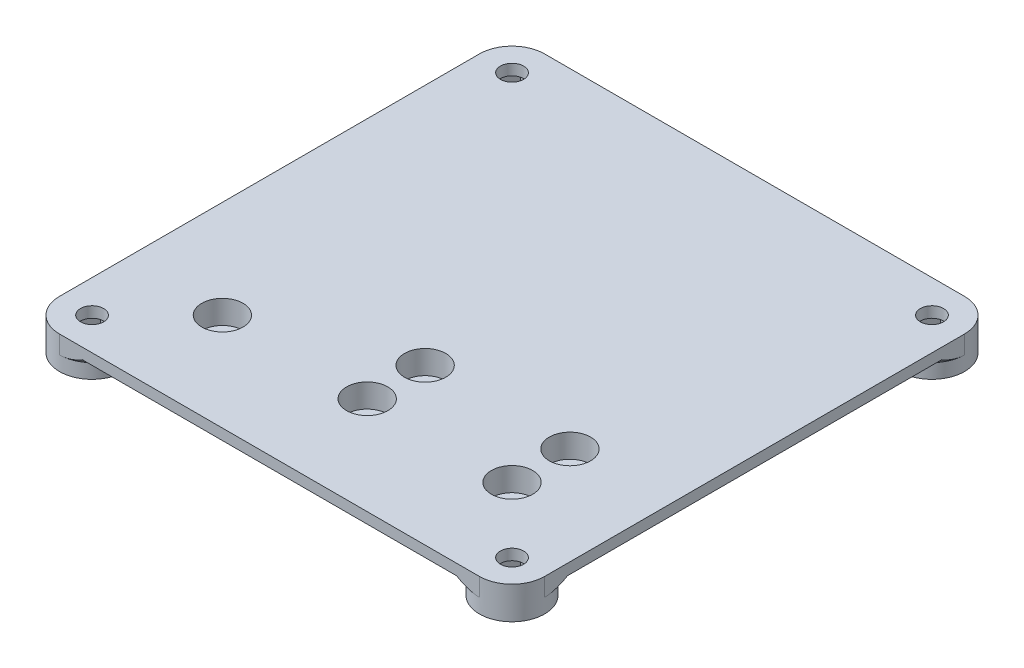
SolidWorks part; units mm, degrees
ref_plane "前视基准面" through (0, 0, 0) normal (0, 0, 1) x (1, 0, 0)
ref_plane "上视基准面" through (0, 0, 0) normal (0, 1, 0) x (1, 0, 0)
ref_plane "右视基准面" through (0, 0, 0) normal (1, 0, 0) x (0, 0, -1)
other "Configuration Table"
sketch "草图1" plane through (0, 0, 0) normal (0, 1, 0) x (1, 0, 0)
  line L0 (-29, 29) -> (29, 29) construction
  line L1 (-33.5, -33.5) -> (33.5, -33.5)
  line L2 (-33.5, -33.5) -> (-33.5, 33.5)
  line L3 (-33.5, 33.5) -> (33.5, 33.5)
  line L4 (33.5, -33.5) -> (33.5, 33.5)
  line L5 (-33.5, -33.5) -> (33.5, 33.5) construction
  line L6 (-33.5, 33.5) -> (33.5, -33.5) construction
  line L7 (-29, 29) -> (-29, -29) construction
  circle A0 centre (-29, 29) radius 1.6
  circle A1 centre (29, 29) radius 1.6
  circle A2 centre (29, -29) radius 1.6
  circle A3 centre (-29, -29) radius 1.6
  point P0 (0, 0)
  dimension "D1" = 3.2
  dimension "D2" = 2
  dimension "D3" = 90
  dimension "D4" = 58
  dimension "D5" = 58
  dimension "D6" = 29
  dimension "D7" = 29
  dimension "D8" = 4.5
  dimension "D9" = 4.5
extrude "凸台-拉伸1" add sketch "草图1" along normal blind 1.5
sketch "草图2" plane through (0, 0, 0) normal (0, -1, 0) x (1, 0, 0)
  line L0 (-20, 24) -> (20, 24)
  line L1 (24, 20) -> (24, 12)
  line L2 (20, 8) -> (0, 8)
  line L3 (-1.4856, 8.2861) -> (-21.4856, 16.2861)
  circle A0 centre (-20, 20) radius 1.3266
  circle A1 centre (0, 12) radius 1.3266
  circle A2 centre (20, 20) radius 1.3266
  circle A3 centre (0, 20) radius 1.3266
  circle A4 centre (20, 12) radius 1.3266
  arc A5 (0, 8) -> (-1.4856, 8.2861) centre (0, 12) cw
  arc A6 (24, 12) -> (20, 8) centre (20, 12) cw
  arc A7 (20, 24) -> (24, 20) centre (20, 20) cw
  arc A8 (-20, 24) -> (-21.4856, 16.2861) centre (-20, 20) ccw
  dimension "D1" = 2.6532
  dimension "D11" = 4
  dimension "D2" = 20
  dimension "D3" = 20
  dimension "D4" = 8
  dimension "D5" = 4
  dimension "D6" = 4
  dimension "D7" = 4
  dimension "D8" = 4
  dimension "D9" = 4
  dimension "D10" = 12
extrude "凸台-拉伸2" add sketch "草图2" along normal blind 8
sketch "草图3" plane through (0, 0, 0) normal (0, -1, 0) x (1, 0, 0)
  circle A0 centre (-20, 20) radius 2.85
  circle A1 centre (0, 20) radius 2.85
  circle A2 centre (0, 12) radius 2.85
  circle A3 centre (20, 12) radius 2.85
  circle A4 centre (20, 20) radius 2.85
  dimension "D1" = 5.7
extrude "切除-拉伸1" cut sketch "草图3" against normal mid plane 3.5
fillet "圆角1" radius 4.5 4 edges at (33.5, 0.75, 33.5) (33.5, 0.75, -33.5) (-33.5, 0.75, -33.5) (-33.5, 0.75, 33.5)
sketch "草图4" plane through (0, 0, 0) normal (0, -1, 0) x (1, 0, 0)
  line L0 (32.1466, 29) -> (30.5733, 31.725)
  line L1 (-25.8534, 29) -> (-27.4267, 31.725)
  line L2 (-27.4267, 31.725) -> (-30.5733, 31.725)
  line L3 (-30.5733, 31.725) -> (-32.1466, 29)
  line L4 (-32.1466, 29) -> (-30.5733, 26.275)
  line L5 (-30.5733, 26.275) -> (-27.4267, 26.275)
  line L6 (-27.4267, 26.275) -> (-25.8534, 29)
  line L7 (30.5733, 31.725) -> (27.4267, 31.725)
  line L8 (27.4267, 31.725) -> (25.8534, 29)
  line L9 (25.8534, 29) -> (27.4267, 26.275)
  line L10 (27.4267, 26.275) -> (30.5733, 26.275)
  line L11 (30.5733, 26.275) -> (32.1466, 29)
  line L12 (32.1466, -29) -> (30.5733, -26.275)
  line L13 (30.5733, -26.275) -> (27.4267, -26.275)
  line L14 (27.4267, -26.275) -> (25.8534, -29)
  line L15 (25.8534, -29) -> (27.4267, -31.725)
  line L16 (27.4267, -31.725) -> (30.5733, -31.725)
  line L17 (30.5733, -31.725) -> (32.1466, -29)
  line L18 (-25.8534, -29) -> (-27.4267, -26.275)
  line L19 (-27.4267, -26.275) -> (-30.5733, -26.275)
  line L20 (-30.5733, -26.275) -> (-32.1466, -29)
  line L21 (-32.1466, -29) -> (-30.5733, -31.725)
  line L22 (-30.5733, -31.725) -> (-27.4267, -31.725)
  line L23 (-27.4267, -31.725) -> (-25.8534, -29)
  circle A0 centre (-29, 29) radius 4.5
  circle A1 centre (-29, 29) radius 2.725 construction
  circle A2 centre (29, 29) radius 4.5
  circle A3 centre (29, -29) radius 4.5
  circle A4 centre (-29, -29) radius 4.5
  point P4 (24.1149, -20.0742)
  point P12 (29, -29)
  point P13 (-29, -29)
  dimension "D1" = 5.45
  dimension "D2" = 2
  dimension "D3" = 2
extrude "凸台-拉伸3" add sketch "草图4" along normal blind 3
chamfer "倒角2" distance 1 distance2 1 4 edges at (-25.818, 0, -25.818) (25.818, 0, 25.818) (25.818, 0, -25.818) (-25.818, 0, 25.818)
sketch "草图6" plane through (0, 0, 0) normal (1, 0, 0) x (0, 0, -1)
  line L0 (-8, -8) -> (-8, 0)
  line L1 (-8, 0) -> (27, 0)
  line L2 (-25.8377, 0) -> (25.8377, 0) construction
  line L3 (27, 0) -> (-8, -8)
  dimension "D1" = 35
extrude "凸台-拉伸5" add sketch "草图6" along normal blind 10
chamfer "倒角4" distance 2.2 12 edges at (10, -4, 8) (10, 0, -9.5) (0, -4, 8) (0, 0, -9.5) (15, 0, 8) (22.8284, 0, 9.1716) (24, 0, 16) (22.8284, 0, 22.8284) (0, 0, 24) (-23.9278, 0, 20.7564) (-0.7564, 0, 8.0722) (-11.4856, 0, 12.2861)
